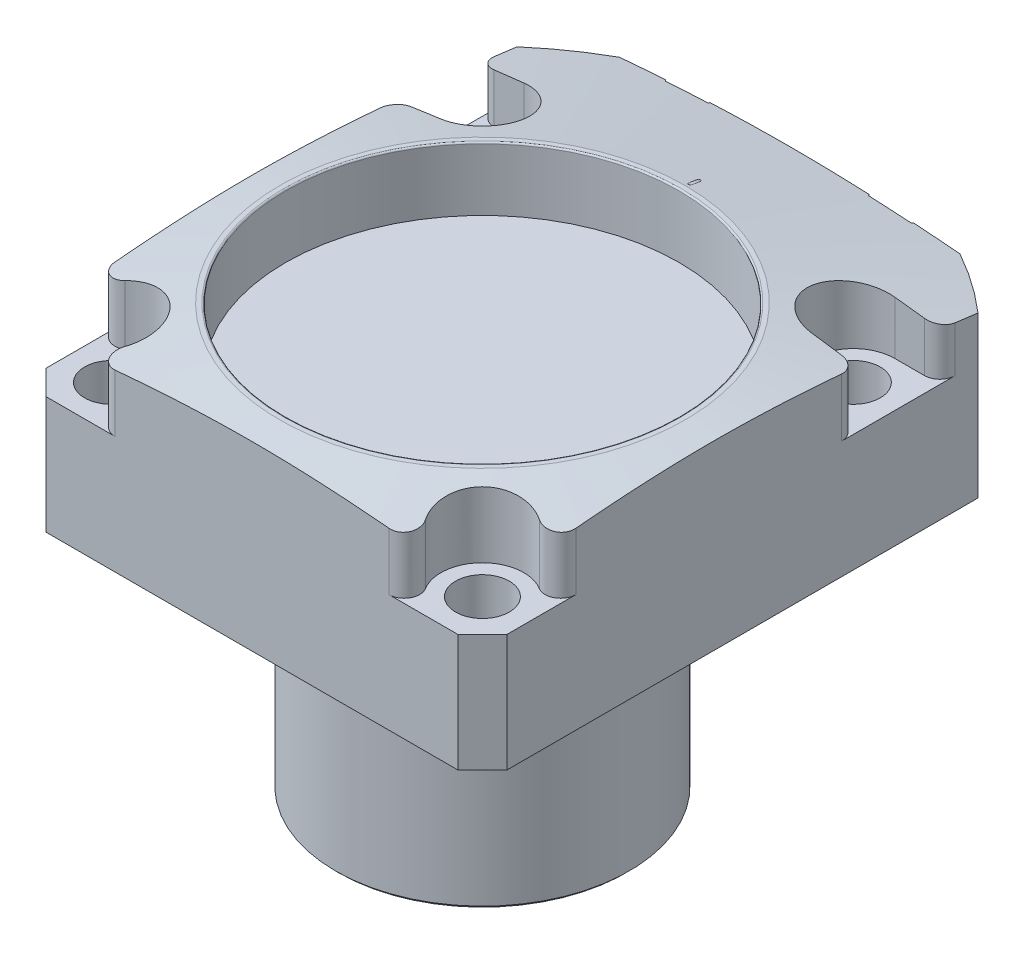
SolidWorks part; units mm, degrees
ref_plane "Front Plane" through (0, 0, 0) normal (0, 0, 1) x (1, 0, 0)
ref_plane "Top Plane" through (0, 0, 0) normal (0, 1, 0) x (1, 0, 0)
ref_plane "Right Plane" through (0, 0, 0) normal (1, 0, 0) x (0, 0, -1)
sketch "Sketch6" plane through (0, 0, 0) normal (0, 0, 1) x (1, 0, 0)
  line L0 (0, -8.9689) -> (0, 71.3762) construction
  line L1 (32.015, 30.3276) -> (33, 30.3276)
  line L2 (33, 30.3276) -> (57.15, 26.0693)
  line L3 (57.15, 26.0693) -> (57.15, 0)
  line L4 (57.15, 0) -> (23.885, 0)
  line L5 (23.885, 0) -> (23.885, -38.3032)
  line L6 (23.885, -38.3032) -> (0, -38.3032)
  line L7 (0, -38.3032) -> (0, 19.9898)
  line L8 (32.015, 30.3276) -> (32.015, 19.9898)
  line L9 (32.015, 19.9898) -> (0, 19.9898)
  dimension "D1" = 47.77
  dimension "D2" = 30.3276
  dimension "D3" = 38.3032
  dimension "D4" = 114.3
  dimension "D5" = 10
  dimension "D6" = 66
  dimension "D7" = 10.3378
  dimension "D8" = 64.03
  dimension "D9" = 68.6308
revolve "Revolve3" add sketch "Sketch6" angle 360 about L0
fillet "Fillet7" radius 0.25 1 edges at (0, 30.3276, -32.015)
sketch "Sketch7" plane through (0, 0, 0) normal (0, -1, 0) x (1, 0, 0)
  line L0 (0, 0) -> (0, -52.3237) construction
  line L1 (-37.5, 37.5) -> (37.5, 37.5)
  line L2 (-37.5, 37.5) -> (-37.5, -50)
  line L3 (-37.5, -50) -> (37.5, -50)
  line L4 (37.5, 37.5) -> (37.5, -50)
  dimension "D1" = 75
  dimension "D2" = 87.5
  dimension "D3" = 37.5
  dimension "D4" = 50
  dimension "D5" = 37.5
extrude "Cut-Extrude5" cut sketch "Sketch7" against normal through all flip side to cut
sketch "Sketch8" plane through (0, 0, 0) normal (0, -1, 0) x (1, 0, 0)
  circle A0 centre (-30.1752, 30.1752) radius 4.3688
  dimension "D1" = 8.7376
  dimension "D2" = 30.1752
  dimension "D3" = 30.1752
extrude "Cut-Extrude6" cut sketch "Sketch8" against normal through all
pattern_circular "CirPattern2" count 4 over 360 about axis through (0, 0, 0) along (0, 1, 0) of "Cut-Extrude6"
chamfer "Chamfer1" distance 4 angle 45 2 edges at (-37.5, 13.3976, 37.5) (37.5, 13.3976, 37.5)
sketch "Sketch9" plane through (0, 30.3276, 0) normal (0, 1, 0) x (1, 0, 0)
  line L0 (-37.5, -33.5) -> (-33.5, -37.5) construction
  line L1 (-33.5, -37.5) -> (33.5, -37.5) construction
  line L2 (37.5, 36.9189) -> (37.5, 23.4315)
  line L3 (-37.5, -33.5) -> (-33.5, -37.5)
  line L4 (37.5, 23.4315) -> (30.1752, 23.4315)
  line L5 (30.1752, 36.9189) -> (37.5, 36.9189)
  line L6 (-30.1752, 36.9189) -> (-37.5, 36.9189)
  line L7 (-37.5, 43.1262) -> (-37.5, -33.5) construction
  line L8 (-37.5, 23.4315) -> (-30.1752, 23.4315)
  line L9 (-37.5, 36.9189) -> (-37.5, 23.4315)
  line L10 (-33.5, -37.5) -> (-27.963, -37.5)
  line L11 (0, 0) -> (0, 26.6366) construction
  line L13 (-37.5, -27.963) -> (-34.9437, -25.4067)
  line L14 (-25.4067, -34.9437) -> (-27.963, -37.5)
  line L15 (-37.5, -27.963) -> (-37.5, -33.5)
  line L16 (37.5, -27.963) -> (37.5, -33.5)
  line L17 (25.4067, -34.9437) -> (27.963, -37.5)
  line L18 (37.5, -27.963) -> (34.9437, -25.4067)
  line L19 (33.5, -37.5) -> (27.963, -37.5)
  line L20 (37.5, -33.5) -> (33.5, -37.5)
  arc A0 (-25.4067, -34.9437) -> (-34.9437, -25.4067) centre (-30.1752, -30.1752) ccw
  arc A1 (-30.1752, 23.4315) -> (-30.1752, 36.9189) centre (-30.1752, 30.1752) ccw
  arc A2 (25.4067, -34.9437) -> (34.9437, -25.4067) centre (30.1752, -30.1752) cw
  arc A3 (30.1752, 23.4315) -> (30.1752, 36.9189) centre (30.1752, 30.1752) cw
  dimension "D1" = 13.4874
extrude "Cut-Extrude7" cut sketch "Sketch9" against normal offset from surface (11.2268 mm away) 19.1008
fillet "Fillet4" radius 2.5 8 edges at (-37.5, 23.7251, -23.4315) (37.5, 22.9841, -36.9189) (37.5, 23.7251, -23.4315) (37.5, 23.4995, 27.963) (27.963, 23.4995, 37.5) (-27.963, 23.4995, 37.5) (-37.5, 23.4995, 27.963) (-37.5, 22.9841, -36.9189)
fillet "Fillet5" radius 0.4 1 edges at (0, 0, -23.885)
chamfer "Chamfer2" distance 0.5 angle 45 1 edges at (0, -38.3032, -23.885)
ref_plane "Plane1" through (0, 17.018, 0) normal (0, -1, 0) x (1, 0, 0)
sketch "Sketch11" plane through (0, 17.018, 0) normal (0, -1, 0) x (1, 0, 0)
  line L0 (-16, -4.7006) -> (-16, -58.3255) construction
  line L1 (-27.6789, -50) -> (27.6789, -50) construction
  line L2 (-22.1849, -49.75) -> (-21.6396, -47.1846)
  line L3 (-21.6396, -47.1846) -> (-20.9784, -46.5234)
  line L10 (-16, -50) -> (-26.4775, -50)
  line L11 (-16, -35.018) -> (-16, -50)
  line L12 (-20.9784, -35.018) -> (-16, -35.018)
  line L13 (-20.9784, -46.5234) -> (-20.9784, -35.018)
  line L15 (-26.4775, -49.75) -> (-22.1849, -49.75)
  line L16 (-26.4775, -50) -> (-26.4775, -49.75)
  dimension "D1" = 16
  dimension "D2" = 0.25
  dimension "D3" = 14.732
  dimension "D4" = 9.9568
  dimension "D5" = 20.955
  dimension "D6" = 12
  dimension "D7" = 12.3698
  dimension "D8" = 45
  dimension "D9" = 2.5654
revolve "Cut-Revolve5" cut sketch "Sketch11" angle 360 about L0
ref_plane "Plane2" through (0, 0, -41.7576) normal (0, 0, 1) x (1, 0, 0)
sketch "Sketch13" plane through (0, 0, -41.7576) normal (0, 0, 1) x (1, 0, 0)
  line L0 (-19.4544, 17.7546) -> (-19.4544, 5.5009)
  line L1 (-20.572, 2.7432) -> (-20.1293, 4.826)
  line L2 (-20.572, 2.7432) -> (-21.6261, 2.7432)
  line L3 (-21.6261, 2.7432) -> (-21.6261, 0)
  line L4 (-24.285, 0) -> (24.285, 0) construction
  line L5 (-21.6261, 0) -> (-16, 0)
  line L6 (-16, 0) -> (-16, 17.7546)
  line L7 (-16, 17.7546) -> (-19.4544, 17.7546)
  line L8 (-16, 13.0098) -> (-16, -4.3918) construction
  line L9 (-20.1293, 4.826) -> (-19.4544, 5.5009)
  line L10 (-20.572, 2.7432) -> (-16, 2.7432) construction
  dimension "D1" = 16
  dimension "D2" = 6.9088
  dimension "D3" = 15.0114
  dimension "D4" = 2.7432
  dimension "D5" = 11.2522
  dimension "D6" = 45
  dimension "D7" = 2.0828
  dimension "D8" = 12
  dimension "D9" = 9.144
revolve "Cut-Revolve6" cut sketch "Sketch13" angle 360 about L8
sketch "Sketch1" plane through (-3.5242, 5.6324, -41.7576) normal (0, 0, 1) x (1, 0, 0)
  line L0 (-12.4758, 0) -> (-12.4758, 50000) construction
  line L1 (-10.8883, 2.521) -> (-8.6023, 2.521)
  line L2 (-8.6023, 2.521) -> (-8.6023, -0.3754)
  line L3 (-8.5642, -2.8892) -> (50000, -2.8892) construction
  line L4 (-9.4786, -1.289) -> (-9.4786, -1.9748)
  line L5 (-8.5642, -2.8892) -> (-7.0148, -2.8892)
  line L6 (-7.0148, -2.8892) -> (-7.0148, -4.3116)
  line L7 (-7.0148, -4.3116) -> (-7.6928, -4.3116)
  line L8 (-9.8088, -4.3116) -> (-9.8088, -5.4292)
  line L9 (-9.8088, -5.4292) -> (-10.8883, -5.4292)
  line L10 (-10.8883, -5.4292) -> (-10.8883, 2.521)
  line L11 (-1000, -2.8892) -> (-10.8883, -2.8892) construction
  line L12 (-8.1147, -4.3116) -> (-9.8088, -4.3116)
  arc A0 (-8.6023, -0.3754) -> (-9.4786, -1.289) centre (-8.5642, -1.289) ccw
  arc A1 (-9.4786, -1.9748) -> (-8.5642, -2.8892) centre (-8.5642, -1.9748) ccw
  arc A2 (-8.1147, -4.3116) -> (-7.6928, -4.3116) centre (-7.9038, -5.1752) ccw
  dimension "D8" = 1.6002
  dimension "D9" = 0.9144
  dimension "D10" = 7.9502
  dimension "D11" = 1.778
  dimension "D1" = 7.747
  dimension "D2" = 5.9944
  dimension "D3" = 10.922
  dimension "D4" = 5.334
  dimension "D5" = 3.175
  dimension "D6" = 1.4224
  dimension "D7" = 2.54
  dimension "D12" = 0.8636
revolve "Revolve1" add sketch "Sketch1" angle 360 about L0
sketch "Sketch2" plane through (-16, 0.2032, -41.7576) normal (0, -1, 0) x (0, 0, 1)
  line L0 (0, 0) -> (0, 50000) construction
  line L1 (0, 1.8331) -> (1.5875, 0.9165)
  line L2 (1.5875, 0.9165) -> (1.5875, -0.9165)
  line L3 (1.5875, -0.9165) -> (0, -1.8331)
  line L4 (0, -1.8331) -> (-1.5875, -0.9165)
  line L5 (-1.5875, -0.9165) -> (-1.5875, 0.9165)
  line L6 (-1.5875, 0.9165) -> (0, 1.8331)
  circle A0 centre (0, 0) radius 1.5875 construction
  dimension "D1" = 3.175
extrude "Cut-Extrude1" cut sketch "Sketch2" against normal up to surface (7.9502 mm away)
other "PORT_ADTAPTER<1>"
mirror "Mirror4" about plane through (0, 0, 0) normal (1, 0, 0) of "Revolve1", "Cut-Extrude1", "Cut-Revolve5", "Cut-Revolve6"
sketch "Sketch17" plane through (0, 0, 0) normal (1, 0, 0) x (0, 0, -1)
  line L0 (33.1793, 31.0677) -> (36.0752, 30.5571) construction
  line L1 (33.4924, 30.2408) -> (35.462, 29.8935) construction
  line L2 (50, 27.33) -> (33, 30.3276) construction
  line L3 (33.8704, 30.9459) -> (35.348, 30.6853) construction
  line L5 (33.7315, 30.158) -> (35.2091, 29.8975)
  line L6 (33.0825, 31.0848) -> (36.1358, 30.5464)
  arc A0 (33.0825, 31.0848) -> (33.7315, 30.158) centre (33.8704, 30.9459) ccw
  arc A1 (35.2091, 29.8975) -> (36.1358, 30.5464) centre (35.348, 30.6853) ccw
  dimension "D2" = 1.6
  dimension "D1" = 0.76
  dimension "D3" = 2
  dimension "D4" = 0.5
revolve "Cut-Revolve7" cut sketch "Sketch17" angle 360 about L0
